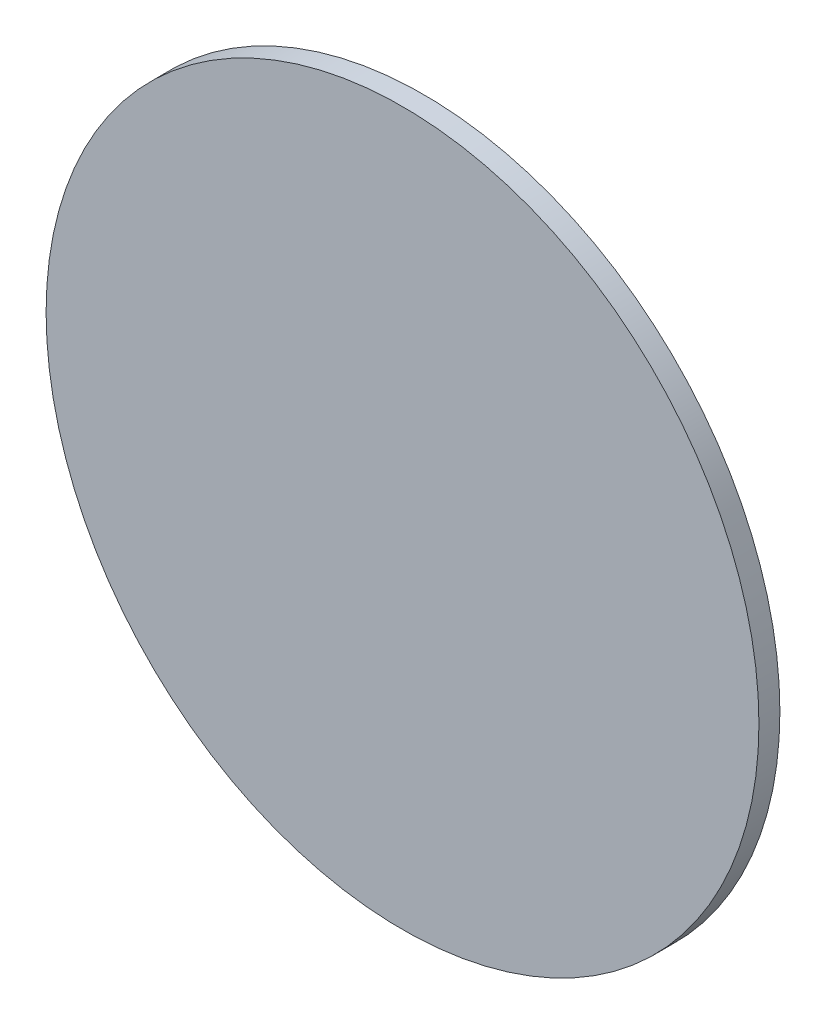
SolidWorks part; units mm, degrees
ref_plane "Plane1" through (0, 0, 0) normal (0, 0, 1) x (1, 0, 0)
ref_plane "Plane2" through (0, 0, 0) normal (0, 1, 0) x (1, 0, 0)
ref_plane "Plane3" through (0, 0, 0) normal (1, 0, 0) x (0, 0, -1)
sketch "Sketch1" plane through (0, 0, 0) normal (0, 0, 1) x (1, 0, 0)
  circle A0 centre (0, 0) radius 1.7
  dimension "D1" = 3.4
extrude "Base-Extrude" add sketch "Sketch1" along normal blind 0.1
